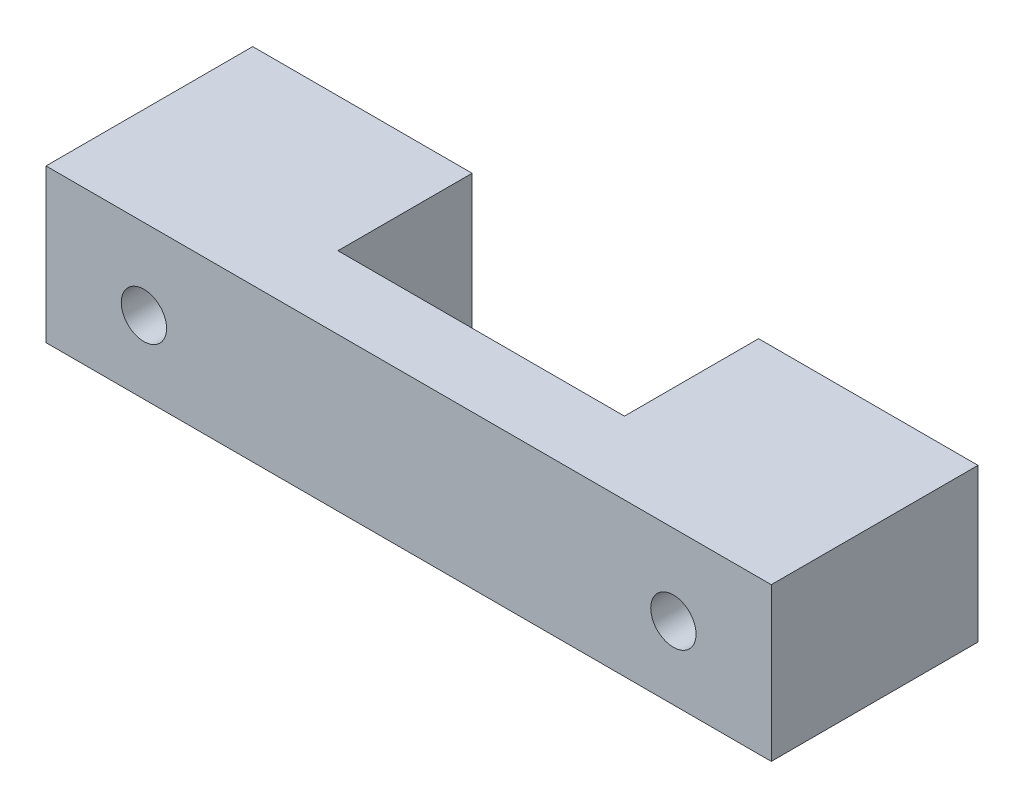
SolidWorks part; units mm, degrees
ref_plane "Front Plane" through (0, 0, 0) normal (0, 0, 1) x (1, 0, 0)
ref_plane "Top Plane" through (0, 0, 0) normal (0, 1, 0) x (1, 0, 0)
ref_plane "Right Plane" through (0, 0, 0) normal (1, 0, 0) x (0, 0, -1)
sketch "Sketch1" plane through (0, 0, 0) normal (0, 0, 1) x (1, 0, 0)
  line L0 (0, 13.335) -> (0, 22.1383) construction
  line L1 (-10.033, 25.0724) -> (-25.4, 25.0724)
  line L2 (-10.033, 14.351) -> (-10.033, 25.0724)
  line L3 (25.4, 25.0724) -> (25.4, 14.351)
  line L4 (25.4, 14.351) -> (10.033, 14.351)
  line L7 (-4.9187, 13.335) -> (4.9187, 13.335) construction
  line L8 (10.033, 14.351) -> (10.033, 25.0724)
  line L9 (10.033, 38.1) -> (10.033, 10.5847) construction
  line L11 (10.033, 25.0724) -> (25.4, 25.0724)
  line L12 (-25.4, 14.351) -> (-10.033, 14.351)
  line L13 (-25.4, 25.0724) -> (-25.4, 14.351)
  point P8 (0, 13.335)
  dimension "D2" = 25.4
extrude "Extrude1" add sketch "Sketch1" along normal blind 9.398
sketch "Sketch2" plane through (0, 0, 9.398) normal (0, 0, 1) x (1, 0, 0)
  line L0 (25.4, 25.0724) -> (10.033, 25.0724) construction
  line L1 (-25.4, 14.351) -> (25.4, 14.351)
  line L2 (-25.4, 14.351) -> (-25.4, 25.0724)
  line L3 (-25.4, 25.0724) -> (25.4, 25.0724)
  line L4 (25.4, 14.351) -> (25.4, 25.0724)
  line L5 (25.4, 14.351) -> (25.4, 25.0724) construction
extrude "Extrude2" add sketch "Sketch2" along normal blind 5.08
sketch "Sketch3" plane through (0, 0, 0) normal (0, 0, -1) x (-1, 0, 0)
  circle A0 centre (-18.5431, 19.4336) radius 1.5875
  circle A1 centre (18.5431, 19.4336) radius 1.5875
extrude "Cut-Extrude1" cut sketch "Sketch3" against normal through all
